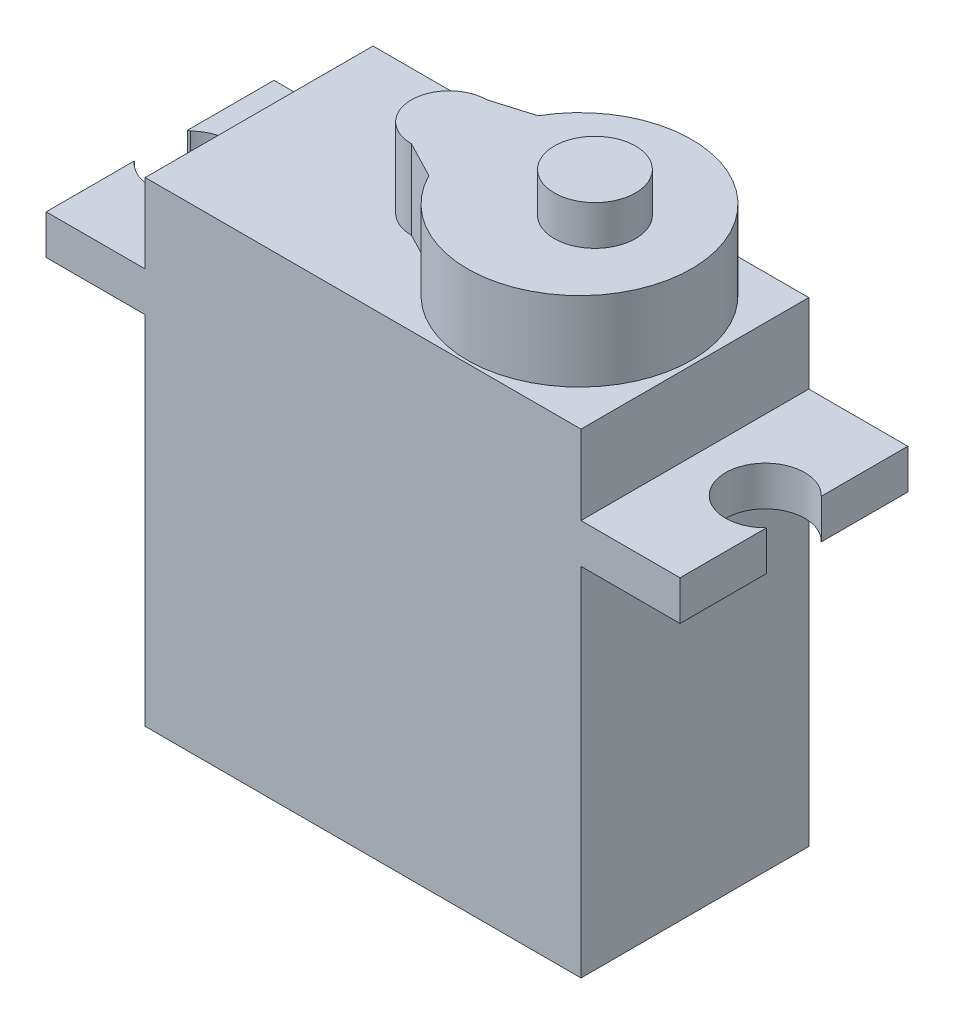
SolidWorks part; units mm, degrees
ref_plane "Front Plane" through (0, 0, 0) normal (0, 0, 1) x (1, 0, 0)
ref_plane "Top Plane" through (0, 0, 0) normal (0, 1, 0) x (1, 0, 0)
ref_plane "Right Plane" through (0, 0, 0) normal (1, 0, 0) x (0, 0, -1)
sketch "Sketch1" plane through (0, 0, 0) normal (0, 1, 0) x (1, 0, 0)
  line L1 (-15.1804, 3.0459) -> (6.8196, 3.0459)
  line L2 (-15.1804, 3.0459) -> (-15.1804, -8.4541)
  line L3 (-15.1804, -8.4541) -> (6.8196, -8.4541)
  line L4 (6.8196, 3.0459) -> (6.8196, -8.4541)
  dimension "D1" = 22
  dimension "D2" = 11.5
extrude "Boss-Extrude1" add sketch "Sketch1" along normal blind 24
sketch "Sketch6" plane through (0, 0, 0) normal (0, 1, 0) x (1, 0, 0)
  line L0 (-24.7537, -2.7041) -> (18.4916, -2.7041) construction
sketch "Sketch2" plane through (6.8196, 0, 0) normal (1, 0, 0) x (0, 0, -1)
  line L0 (-8.4541, 24) -> (-8.4541, 0) construction
  line L1 (-8.4541, 20) -> (3.0459, 20)
  line L2 (-8.4541, 20) -> (-8.4541, 18)
  line L3 (-8.4541, 18) -> (3.0459, 18)
  line L4 (3.0459, 20) -> (3.0459, 18)
  line L5 (3.0459, 24) -> (3.0459, 0) construction
  line L6 (-8.4541, 24) -> (3.0459, 24) construction
  dimension "D1" = 4
  dimension "D2" = 2
extrude "Boss-Extrude2" add sketch "Sketch2" along normal blind 5 and the other way blind 27
sketch "Sketch3" plane through (0, 20, 0) normal (0, 1, 0) x (1, 0, 0)
  line L5 (13.5031, -1.6266) -> (12.0573, -1.6266)
  line L6 (13.5031, -1.6266) -> (13.5031, -3.6911)
  line L7 (13.5031, -3.6911) -> (12.0573, -3.7816)
  line L11 (-20.0643, -1.2759) -> (-22.3111, -2.1442)
  line L12 (-22.3111, -2.1442) -> (-22.3111, -3.6911)
  line L13 (-22.3111, -3.6911) -> (-20.295, -3.862)
  line L14 (-24.7537, -2.7041) -> (18.4916, -2.7041) construction
  arc A1 (12.0573, -1.6266) -> (12.0573, -3.7816) centre (10.3723, -2.7041) ccw
  arc A3 (-20.295, -3.862) -> (-20.0643, -1.2759) centre (-18.6643, -2.7041) ccw
  point P0 (13.5031, -3.7816)
  dimension "D1" = 2
extrude "Cut-Extrude3" cut sketch "Sketch3" against normal blind 7
sketch "Sketch4" plane through (0, 24, 0) normal (0, 1, 0) x (1, 0, 0)
  line L0 (-5.9432, -0.428) -> (-3.9598, 0.1667)
  line L1 (-5.9432, -4.2564) -> (-4.1027, -5.2113)
  arc A0 (-4.1027, -5.2113) -> (-3.9598, 0.1667) centre (0.9455, -2.6545) ccw
  arc A1 (-5.9432, -0.428) -> (-5.9432, -4.2564) centre (-5.9432, -2.3422) ccw
extrude "Boss-Extrude5" add sketch "Sketch4" along normal blind 4
sketch "Sketch5" plane through (0, 24, 0) normal (0, 1, 0) x (1, 0, 0)
  line L2 (6.8196, -8.4541) -> (6.8196, 3.0459) construction
  circle A0 centre (1.8196, -2.7497) radius 2.0513
  point P2 (3.8766, -2.7497)
  point P6 (-5.1804, 1.0459)
  dimension "D1" = 5
extrude "Boss-Extrude4" add sketch "Sketch5" along normal blind 6
